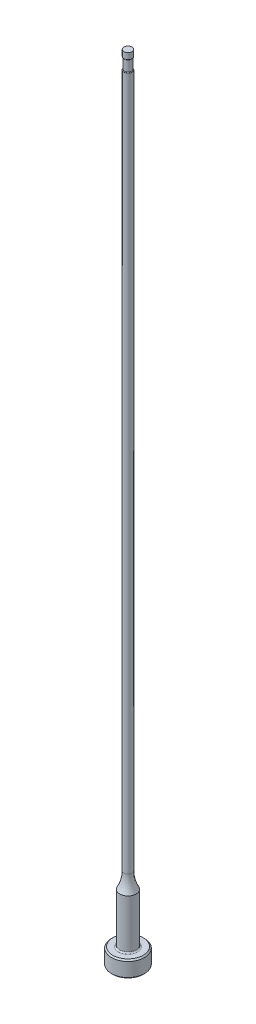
SolidWorks part; units mm, degrees
ref_plane "Front Plane" through (0, 0, 0) normal (0, 0, 1) x (1, 0, 0)
ref_plane "Top Plane" through (0, 0, 0) normal (0, 1, 0) x (1, 0, 0)
ref_plane "Right Plane" through (0, 0, 0) normal (1, 0, 0) x (0, 0, -1)
other "Configuration Table"
sketch "Sketch1" plane through (0, 0, 0) normal (0, 0, 1) x (1, 0, 0)
  line L0 (0, 259.9588) -> (0, -15.1925) construction
  line L1 (0, 0) -> (-3.175, 0)
  line L2 (-3.175, 0) -> (-3.175, 3.175)
  line L3 (-3.175, 3.175) -> (-1.5875, 3.175)
  line L4 (-0.7937, 15.7742) -> (-0.7937, 152.4)
  line L5 (-0.7937, 152.4) -> (0, 152.4)
  line L6 (0, 152.4) -> (0, 0)
  line L7 (-1.5875, 3.175) -> (-1.5875, 12.7)
  arc A1 (-1.5875, 12.7) -> (-0.7937, 15.7742) centre (-7.1437, 15.7742) ccw
  dimension "D1" = 6.35
  dimension "L" = 152.4
  dimension "D2" = 3.175
  dimension "H" = 6.35
  dimension "T" = 3.175
  dimension "D" = 1.5875
  dimension "S" = 12.7
revolve "Revolve1" add sketch "Sketch1" angle 360 about L0
chamfer "Chamfer1" distance 0.254 angle 45 2 edges at (0, 3.175, 3.175) (0, 0, 3.175)
fillet "Fillet1" radius 0.254 1 edges at (0, 3.175, 1.5875)
sketch "Sketch2" plane through (0, 0, 0) normal (0, 0, 1) x (1, 0, 0)
  line L0 (-0.7937, 152.4) -> (-0.7937, 15.7742) construction
  line L1 (-0.7937, 151.13) -> (-0.6921, 151.13)
  line L2 (-0.7937, 151.13) -> (-0.7937, 149.098)
  line L3 (-0.7937, 149.098) -> (-0.6921, 149.098)
  line L4 (-0.6921, 151.13) -> (-0.6921, 149.098)
  line L5 (0.7937, 152.4) -> (-0.7937, 152.4) construction
  line L6 (0, 153.4483) -> (0, 147.3282) construction
  dimension "D1" = 2.032
  dimension "N" = 1.27
  dimension "FD" = 0.1016
  dimension "D3" = 1.3843
revolve "Vent Relief" cut sketch "Sketch2" angle 360 about L6
sketch "Sketch3" plane through (0, 0, 0) normal (0, 0, 1) x (1, 0, 0)
  line L0 (-0.6921, 150.114) -> (-0.6921, 112.014)
  line L1 (-0.6921, 151.13) -> (-0.6921, 149.098) construction
  line L2 (-0.7937, 149.098) -> (-0.7937, 15.7742) construction
  line L3 (-0.7937, 111.2172) -> (-0.7937, 150.114)
  line L4 (-0.7937, 150.114) -> (-0.6921, 150.114)
  arc A0 (-0.6921, 112.014) -> (-0.7937, 111.2172) centre (-3.8671, 112.014) cw
  dimension "D1" = 3.175
  dimension "D2" = 38.1
extrude "D-Slot" cut sketch "Sketch3" against normal through all both and the other way through all
sketch "Sketch5" plane through (0, 0, 0) normal (0, 0, 1) x (1, 0, 0)
  line L0 (-0.7937, 151.13) -> (0.7937, 151.13) construction
  line L1 (-0.7937, 152.4) -> (-0.781, 152.4)
  line L2 (-0.7937, 152.4) -> (-0.7937, 151.13)
  line L3 (-0.7937, 151.13) -> (-0.781, 151.13)
  line L4 (-0.781, 152.4) -> (-0.781, 151.13)
  line L5 (0, 152.6877) -> (0, 150.5771) construction
  dimension "VP" = 0.0127
revolve "Vent Diameter" cut sketch "Sketch5" angle 360 about L5
fillet "Fillet2" radius 0.127 2 edges at (0.7937, 149.098, 0) (0, 151.13, 0.781)
sketch "Pocket Sketch" plane through (0, 0, 0) normal (0, 0, 1) x (1, 0, 0)
  line L0 (-3.5719, 0) -> (-3.5719, 3.2004)
  line L1 (-3.5719, 3.2004) -> (-1.7542, 3.2004)
  line L2 (-0.9922, 3.9624) -> (-0.9922, 22.225)
  line L3 (-0.9922, 22.225) -> (0, 22.225)
  line L4 (0, 22.225) -> (0, 0)
  line L5 (0, 0) -> (-3.5719, 0)
  line L6 (0, 12.6104) -> (0, -2.4989) construction
  line L7 (-3.175, 2.921) -> (-3.175, 0.254) construction
  line L8 (2.921, 3.175) -> (-2.921, 3.175) construction
  line L9 (-0.7937, 111.2172) -> (-0.7937, 15.7742) construction
  line L10 (-1.7542, 3.2004) -> (-0.9922, 3.9624)
  point P3 (-0.9922, 3.2004)
  dimension "D1" = 7.1437
  dimension "D2" = 0.3969
  dimension "D3" = 0.0254
  dimension "D4" = 0.1984
  dimension "D5" = 1.9844
  dimension "D6" = 22.225
